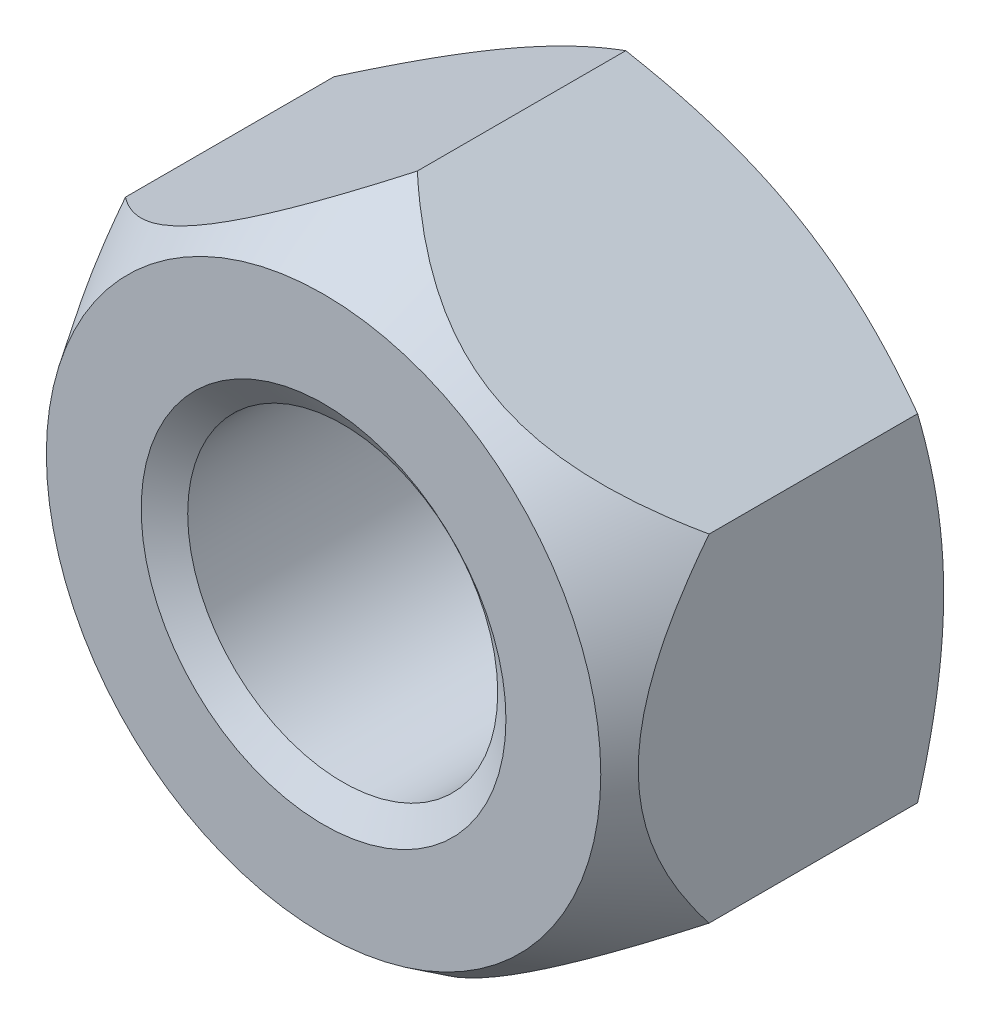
SolidWorks part; units mm, degrees
ref_plane "Plane1" through (0, 0, 0) normal (0, 0, 1) x (1, 0, 0)
ref_plane "Plane2" through (0, 0, 0) normal (0, 1, 0) x (1, 0, 0)
ref_plane "Plane3" through (0, 0, 0) normal (1, 0, 0) x (0, 0, -1)
revolve "EndChamfer" cut sketch "Sketch5"
sketch "Sketch5"
  line L0 (8.9746, 5) -> (8.3969, 4.175)
  line L1 (9.0254, 5) -> (8.9746, 5)
  line L2 (9.0254, 5) -> (9.0254, 4.175)
  line L3 (9.0254, 4.175) -> (8.3969, 4.175)
  line L6 (-0.0508, 5) -> (0, 5)
  line L7 (0, 5) -> (0.5777, 4.175)
  line L9 (0.5777, 4.175) -> (-0.0508, 4.175)
  line L10 (-0.0508, 4.175) -> (-0.0508, 5)
  line L11 (25.0375, 0) -> (38.388, 0) construction
  line L12 (9, 0) -> (0, 0) construction
extrude "BaseNut" add sketch "BaseNutSke" against normal blind 9
sketch "BaseNutSke" plane through (0, 0, 0) normal (0, 0, 1) x (1, 0, 0)
  line L6 (8, 4.6188) -> (8, -4.6188)
  line L7 (-8, 4.6188) -> (-8, -4.6188)
  line L8 (8, 4.6188) -> (0, 9.2376)
  line L9 (0, 9.2376) -> (-8, 4.6188)
  line L10 (-8, -4.6188) -> (0, -9.2376)
  line L11 (0, -9.2376) -> (8, -4.6188)
  circle A0 centre (0, 0) radius 4.25
  dimension "D4" = 8
  dimension "Tap_drill" = 8.5
  dimension "D1" = 120
  dimension "D2" = 8
  dimension "D3" = 8
  dimension "Width_flats" = 16
pattern_linear "ThdSchPat"
revolve "ThreadSchematic" cut sketch "ThdSchSke" angle 360 about L11
sketch "ThdSchSke" plane through (0, 0, 0) normal (0, 1, 0) x (1, 0, 0)
  line L0 (-5, 0.0254) -> (-4.25, 0.5506)
  line L1 (-4.25, 0.5506) -> (-2.125, 0.5506)
  line L2 (-2.125, 0.5506) -> (-2.125, -0.4998)
  line L3 (-2.125, -0.4998) -> (-4.25, -0.4998)
  line L4 (-4.25, -0.4998) -> (-5, 0.0254)
  line L5 (-3.175, 1.5) -> (3.175, 1.5) construction
  line L6 (0, 1.5) -> (0, -2.9874) construction
  line L7 (0, 8.4494) -> (0, 0.5252) construction
  dimension "D1" = 35
  dimension "VeeAngle" = 70
  dimension "SideAngle" = 55
  dimension "D2" = 0.0508
  dimension "OverCut" = 4.25
  dimension "Tap_Drill" = 8.5
  dimension "Advance" = 1.4915
  dimension "Thread_major" = 10
  dimension "Num_threads" = 7
  dimension "D4" = 50
  dimension "Offset1" = 9.0254
  dimension "ThreadMajor" = 5
  dimension "ChamferDepth" = 0.825
  dimension "Offset2" = 9.0762
sketch "Sketch3" plane through (0, 0, 0) normal (1, 0, 0) x (0, 0, -1)
  line L0 (9, 8) -> (8.2855, 9.2376)
  line L1 (8.2855, 9.2376) -> (8.2855, 19.2376)
  line L2 (8.2855, 19.2376) -> (19, 19.2376)
  line L3 (19, 19.2376) -> (19, 8)
  line L4 (19, 8) -> (9, 8)
  line L5 (9, 4.6188) -> (9, 9.2376) construction
  line L6 (9, 9.2376) -> (0, 9.2376) construction
  line L7 (0, 0) -> (38.6776, 0) construction
  line L8 (9, 0) -> (0, 0) construction
  line L10 (2.57, 19.2376) -> (-10, 19.2376)
  line L11 (-10, 19.2376) -> (-10, 7.6)
  line L12 (-10, 7.6) -> (0, 7.6)
  line L13 (0, 7.6) -> (2.57, 9.2376)
  line L14 (2.57, 9.2376) -> (2.57, 19.2376)
  line L15 (9, -4.25) -> (9, 4.25) construction
  line L16 (9, 9.2376) -> (0, 9.2376) construction
  line L17 (0, 4.6188) -> (0, -4.6188) construction
  dimension "D1" = 8
  dimension "D2" = 30
  dimension "D3" = 10
  dimension "D4" = 10
  dimension "D6" = 10
  dimension "D7" = 10
  dimension "D8" = 7.6
  dimension "MinWren_Ht" = 6.43
revolve "Double-Chamfer" cut sketch "Sketch3" angle 360 about L7
equation "\"D2@BaseNutSke\" = \"Width_flats@BaseNutSke\" / 2"
equation "\"D3@BaseNutSke\" = \"Width_flats@BaseNutSke\" / 2"
equation "\"D1@Sketch3\" = \"Width_flats@BaseNutSke\" /2"
equation "\"D4@BaseNutSke\" = \"D3@BaseNutSke\""
equation "\"Tap_drill@ThdSchSke\" = \"Tap_drill@BaseNutSke\""
equation "\"Overcut@ThdSchSke\" = \"Tap_drill@ThdSchSke\" * 0.5"
equation "\"Num_threads@ThdSchPat\" = int(  ( \"Thickness@BaseNut\" - 0.0508 ) / \"Advance@ThdSchSke\" + 0.999 )  + 1"
equation "\"Advance@ThdSchPat\" = ( \"Thickness@BaseNut\" - 0.0508 ) /  (\"Num_threads@ThdSchPat\" - 1) 'relax it"
equation "' \"Num_threads@ThdSchPat\" = \"Num_threads@ThdSchPat\" - sgn( \"Num_threads@ThdSchPat\" - 1) '---chamfered tips only---"
equation "\"ThreadMajor@Sketch5\" = \"Thread_major@ThdSchSke\" * 0.5"
equation "\"ChamferDepth@Sketch5\" = (\"Thread_major@ThdSchSke\" - \"Tap_drill@BaseNutSke\") * 0.55"
equation "\"Offset1@Sketch5\" = \"Thickness@BaseNut\" + 0.0254"
equation "\"Offset2@Sketch5\" = \"Offset1@Sketch5\" + 0.0508"
equation "\"D8@Sketch3\" = 0.95 *\"D1@Sketch3\""
